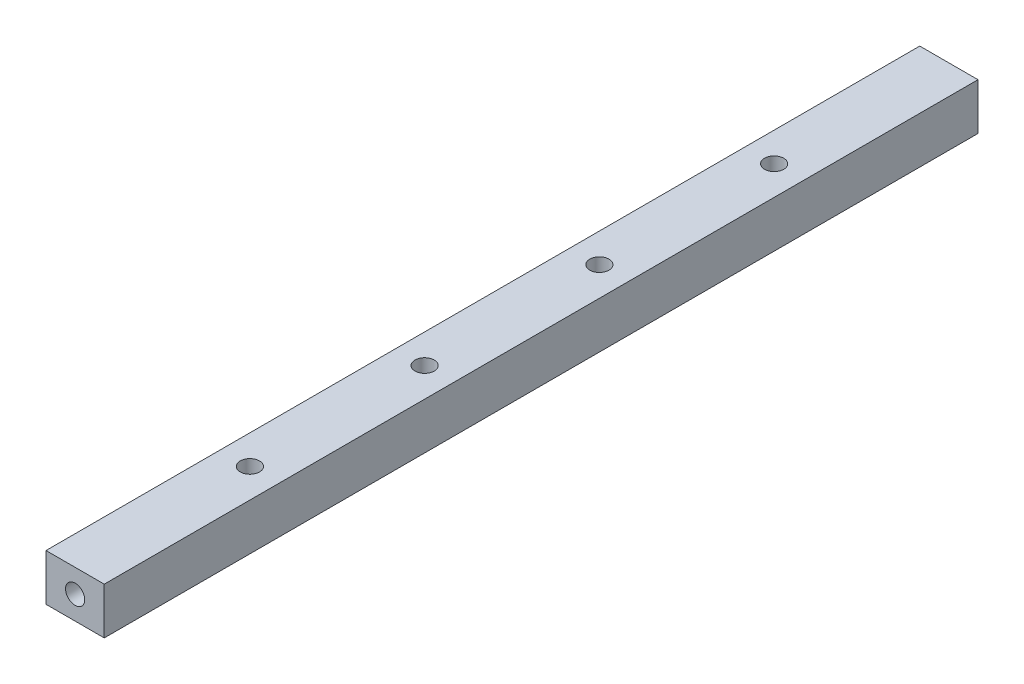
SolidWorks part; units mm, degrees
ref_plane "Plan de face" through (0, 0, 0) normal (0, 0, 1) x (1, 0, 0)
ref_plane "Plan de dessus" through (0, 0, 0) normal (0, 1, 0) x (1, 0, 0)
ref_plane "Plan de droite" through (0, 0, 0) normal (1, 0, 0) x (0, 0, -1)
sketch "Esquisse1" plane through (0, 0, 0) normal (0, 0, 1) x (1, 0, 0)
  line L1 (-5, 4) -> (5, 4)
  line L2 (-5, 4) -> (-5, -4)
  line L3 (-5, -4) -> (5, -4)
  line L4 (5, 4) -> (5, -4)
  dimension "D1" = 8
  dimension "D2" = 4
  dimension "D3" = 5
  dimension "D4" = 10
extrude "Boss.-Extru.1" add sketch "Esquisse1" along normal blind 150
hole_wizard "Trou taraudé M41" positions "Esquisse4" profile "Esquisse3" tap size "M4" standard "ISO"
sketch "Esquisse4" plane through (0, 0, 150) normal (0, 0, 1) x (1, 0, 0)
  point P0 (0, 0)
sketch "Esquisse3" plane through (0, 0, 150) normal (1, 0, 0) x (0, -1, 0)
  line L0 (0, 0) -> (0, 20.9914)
  line L1 (0, 20.9914) -> (1.65, 20)
  line L2 (1.65, 20) -> (1.65, 0)
  line L5 (1.65, 0) -> (0, 0)
  line L10 (0, 20.9914) -> (-1.65, 20) construction
  line L11 (0, -6.35) -> (0, 107.95) construction
  dimension "Diamètre du trou pour taraudage" = 3.3
  dimension "Profondeur du trou pour taraudage" = 20
  dimension "Angle de pointe" = 118
hole_wizard "Trou taraudé M42" positions "Esquisse7" profile "Esquisse6" tap size "M4" standard "ISO"
sketch "Esquisse7" plane through (0, 4, 0) normal (0, 1, 0) x (-1, 0, 0)
  line L0 (-5, 0) -> (5, 0) construction
  point P0 (0, 30)
  dimension "D1" = 30
sketch "Esquisse6" plane through (0, 4, 30) normal (1, 0, 0) x (0, 0, 1)
  line L0 (0, 0) -> (0, 8)
  line L1 (0, 8) -> (1.65, 8)
  line L2 (1.65, 8) -> (1.65, 0)
  line L5 (1.65, 0) -> (0, 0)
  line L11 (0, -6.35) -> (0, 107.95) construction
  dimension "Diamètre du trou pour taraudage jusqu'au prochain" = 3.3
  dimension "Profondeur du trou pour taraudage jusqu'au prochain" = 8
pattern_linear "Répétition linéaire1" count 4 spacing 30 along (0, 0, 1) of "Trou taraudé M42"
